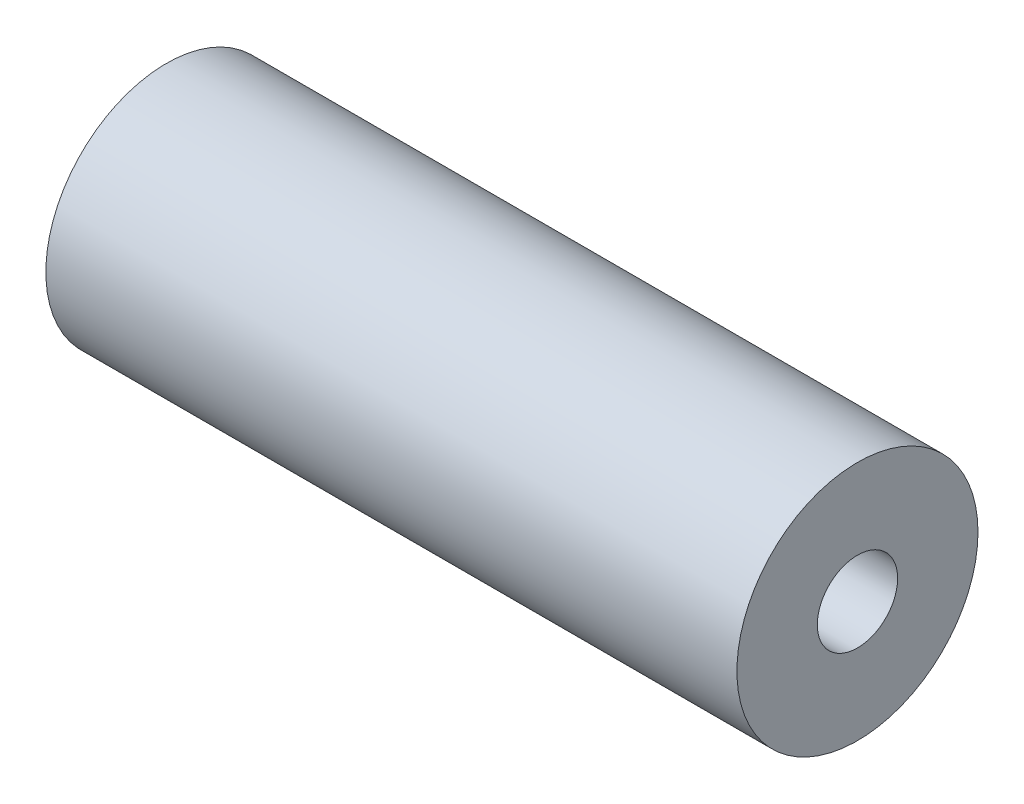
SolidWorks part; units mm, degrees
ref_plane "Front Plane" through (0, 0, 0) normal (0, 0, 1) x (1, 0, 0)
ref_plane "Top Plane" through (0, 0, 0) normal (0, 1, 0) x (1, 0, 0)
ref_plane "Right Plane" through (0, 0, 0) normal (1, 0, 0) x (0, 0, -1)
sketch "Sketch1" plane through (0, 0, 0) normal (1, 0, 0) x (0, 0, -1)
  circle A0 centre (0, 0) radius 7.5
  circle A1 centre (0, 0) radius 2.5
  dimension "D1" = 5
  dimension "D2" = 15
extrude "Boss-Extrude1" add sketch "Sketch1" along normal blind 43
